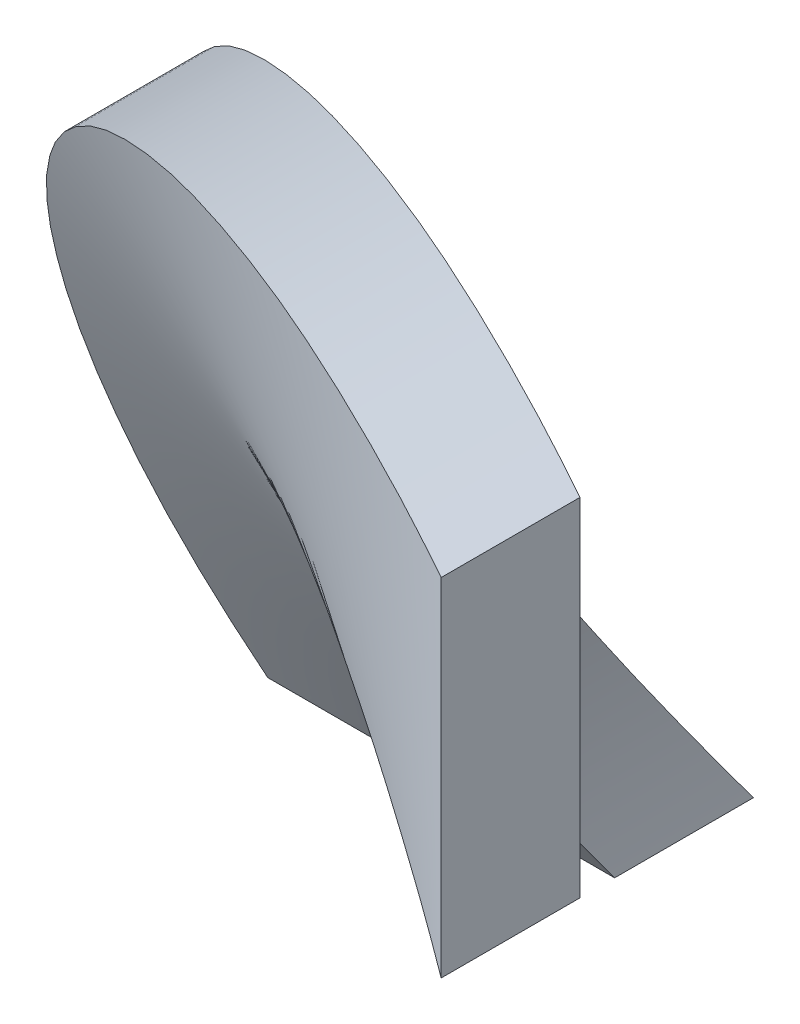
SolidWorks part; units mm, degrees
ref_plane "Přední rovina" through (0, 0, 0) normal (0, 0, 1) x (1, 0, 0)
ref_plane "Horní rovina" through (0, 0, 0) normal (0, 1, 0) x (1, 0, 0)
ref_plane "Pravá rovina" through (0, 0, 0) normal (1, 0, 0) x (0, 0, -1)
sketch "Skica1" plane through (0, 0, 0) normal (0, 0, 1) x (1, 0, 0)
  circle A0 centre (0, 0) radius 17.5
  dimension "D1" = 35
curve "Šroubovice/spirála1"
sketch "Skica6" plane through (0, 0, 0) normal (0, 0, 1) x (1, 0, 0)
  circle A0 centre (0, 0) radius 9.5071
ref_plane "Rovina3" through (-17.5, 0, 0) normal (0, -1, 0) x (-1, 0, 0)
sketch "Skica7" plane through (-17.5, 0, 0) normal (0, -1, 0) x (-1, 0, 0)
  line L1 (2.5, -1) -> (-2.5, -1)
  line L2 (2.5, -1) -> (2.5, 1)
  line L3 (2.5, 1) -> (-2.5, 1)
  line L4 (-2.5, -1) -> (-2.5, 1)
  line L5 (2.5, -1) -> (-2.5, 1) construction
  line L6 (2.5, 1) -> (-2.5, -1) construction
  spline S0 degree 3 poles (0, 0) (0, -1.1633) (-0.5805, -3.5016) (-3.1074, -6.9996) (-7.0432, -10.5001) (-12.0025, -14) (-17.5, -17.5) (-22.9975, -21) (-27.9568, -24.5) (-31.8926, -28) (-34.4195, -31.5) (-35.2902, -35) (-34.4195, -38.5) (-31.8926, -42) (-27.9568, -45.5) (-22.9975, -49) (-17.5, -52.5) (-12.0025, -56) (-7.0432, -59.5) (-3.1074, -63) (-0.5805, -66.5) (0.2902, -70) (-0.5805, -73.5) (-3.1074, -77) (-7.0432, -80.5) (-12.0025, -84) (-17.5, -87.5) (-22.9975, -91) (-27.9568, -94.5) (-31.8926, -98) (-34.4195, -101.5) (-35.2902, -105) (-34.4195, -108.5) (-31.8926, -112) (-27.9568, -115.5) (-22.9975, -119) (-17.5, -122.5) (-12.0025, -126) (-7.0432, -129.5) (-3.1074, -133) (-0.5805, -136.5) (0.2902, -140) (-0.5805, -143.5) (-3.1074, -147) (-7.0432, -150.5) (-12.0025, -154) (-17.5, -157.5) (-22.9975, -161) (-27.9568, -164.5) (-31.8926, -168) (-34.4195, -171.5) (-35.2902, -175) (-34.4195, -178.5) (-31.8926, -182) (-27.9568, -185.5) (-22.9975, -189) (-17.5, -192.5) (-12.0025, -196) (-7.0432, -199.4999) (-3.1074, -203.0004) (-0.5805, -206.4984) (0, -208.8367) (0, -210) knots 0 0 0 0 0.016667 0.033333 0.05 0.066667 0.083333 0.1 0.116667 0.133333 0.15 0.166667 0.183333 0.2 0.216667 0.233333 0.25 0.266667 0.283333 0.3 0.316667 0.333333 0.35 0.366667 0.383333 0.4 0.416667 0.433333 0.45 0.466667 0.483333 0.5 0.516667 0.533333 0.55 0.566667 0.583333 0.6 0.616667 0.633333 0.65 0.666667 0.683333 0.7 0.716667 0.733333 0.75 0.766667 0.783333 0.8 0.816667 0.833333 0.85 0.866667 0.883333 0.9 0.916667 0.933333 0.95 0.966667 0.983333 1 1 1 1 construction
  point P0 (0, 0)
  dimension "D1" = 2
  dimension "D2" = 5
sweep "Táhnout po křivce3" add profiles "Skica7" path "Šroubovice/spirála1"
scale "Měřítko1" scale about origin uniform scaling yes scale factor 0.655
sketch "Skica8" plane through (0, 0, 0) normal (0, 0, 1) x (1, 0, 0)
  line L0 (0, 0) -> (0, 29.8113)
  line L1 (0, 0) -> (26.5621, -13.534)
  circle A0 centre (0, 0) radius 29.8113
  dimension "D1" = 117
extrude "Odebrat vysunutím1" cut sketch "Skica8" along normal through all contours L1 A0 L0
sketch "Skica9" [suppressed] plane through (0, 0, 0) normal (0, 0, 1) x (1, 0, 0)
  circle A0 centre (0, 0) radius 30.3604
ref_plane "Rovina4" through (0, 0, 20) normal (0, 0, 1) x (1, 0, 0)
sketch "Skica10" plane through (0, 0, 20) normal (0, 0, 1) x (1, 0, 0)
  circle A0 centre (0, 0) radius 64.4842
extrude "Odebrat vysunutím2" cut sketch "Skica10" along normal blind 200
